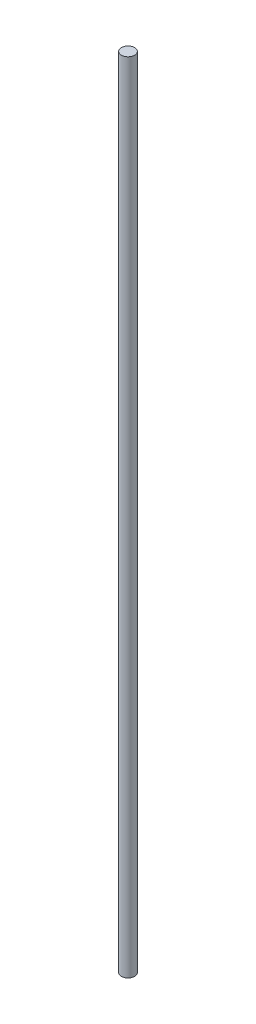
SolidWorks part; units mm, degrees
ref_plane "Front Plane" through (0, 0, 0) normal (0, 0, 1) x (1, 0, 0)
ref_plane "Top Plane" through (0, 0, 0) normal (0, 1, 0) x (1, 0, 0)
ref_plane "Right Plane" through (0, 0, 0) normal (1, 0, 0) x (0, 0, -1)
sketch "Sketch1" plane through (0, 0, 0) normal (0, 1, 0) x (1, 0, 0)
  circle A0 centre (0, 0) radius 4
  dimension "D1" = 8
extrude "Boss-Extrude1" add sketch "Sketch1" along normal blind 482.6 contours A0
